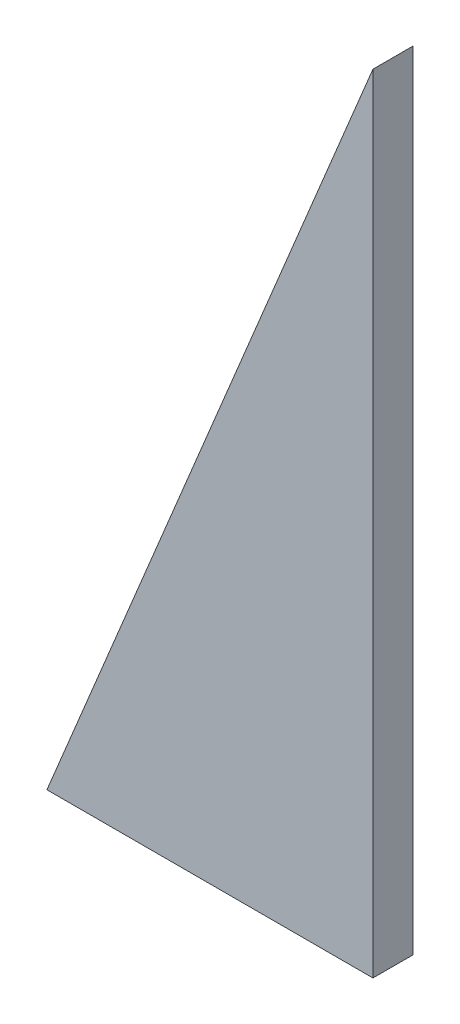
SolidWorks part; units mm, degrees
ref_plane "Przednia" through (0, 0, 0) normal (0, 0, 1) x (1, 0, 0)
ref_plane "Górna" through (0, 0, 0) normal (0, 1, 0) x (1, 0, 0)
ref_plane "Prawa" through (0, 0, 0) normal (1, 0, 0) x (0, 0, -1)
sketch "Szkic1" plane through (0, 0, 0) normal (0, 0, 1) x (1, 0, 0)
  line L0 (0, 0) -> (65, 0)
  line L1 (65, 0) -> (65, 156.9239)
  line L2 (65, 156.9239) -> (0, 0)
  dimension "D1" = 65
  dimension "D2" = 67.5
extrude "Dodanie-wyciągnięcie1" add sketch "Szkic1" along normal blind 8
hole_wizard "Otwór gwintowany M5x0.81" positions "Szkic3" profile "Szkic2" tap size "M5x0.8" standard "Ansi Metric"
sketch "Szkic3" plane through (0, 0, 0) normal (-0.9239, 0.3827, 0) x (0, 0, 1)
  line L0 (4, 0) -> (4, 35)
  line L1 (8, 0) -> (0, 0) construction
  line L2 (4, 35) -> (4, 110)
  point P0 (4, 35)
  point P2 (4, 110)
  dimension "D1" = 35
  dimension "D2" = 110
sketch "Szkic2" plane through (13.3939, 32.3358, 4) normal (0, 0, 1) x (-0.3827, -0.9239, 0)
  line L0 (0, 0) -> (0, 15.2618)
  line L1 (0, 15.2618) -> (2.1, 14)
  line L2 (2.1, 14) -> (2.1, 0)
  line L5 (2.1, 0) -> (0, 0)
  line L10 (0, 15.2618) -> (-2.1, 14) construction
  line L11 (0, -6.35) -> (0, 107.95) construction
  dimension "Średnica wiertła gwintu" = 4.2
  dimension "Głębokość otworu gwintowanego" = 14
  dimension "Kąt wiertła" = 118
hole_wizard "Otwór gwintowany M5x0.82" positions "Szkic5" profile "Szkic4" tap size "M5x0.8" standard "Ansi Metric"
sketch "Szkic5" plane through (0, 0, 0) normal (0, -1, 0) x (-1, 0, 0)
  line L0 (0, -4) -> (-22.5, -4)
  line L1 (0, -8) -> (0, 0) construction
  line L2 (-22.5, -4) -> (-52.5, -4)
  point P0 (-22.5, -4)
  point P2 (-52.5, -4)
  dimension "D1" = 30
  dimension "D2" = 22.5
sketch "Szkic4" plane through (22.5, 0, 4) normal (1, 0, 0) x (0, 0, -1)
  line L0 (0, 0) -> (0, 15.2618)
  line L1 (0, 15.2618) -> (2.1, 14)
  line L2 (2.1, 14) -> (2.1, 0)
  line L5 (2.1, 0) -> (0, 0)
  line L10 (0, 15.2618) -> (-2.1, 14) construction
  line L11 (0, -6.35) -> (0, 107.95) construction
  dimension "Średnica wiertła gwintu" = 4.2
  dimension "Głębokość otworu gwintowanego" = 14
  dimension "Kąt wiertła" = 118
